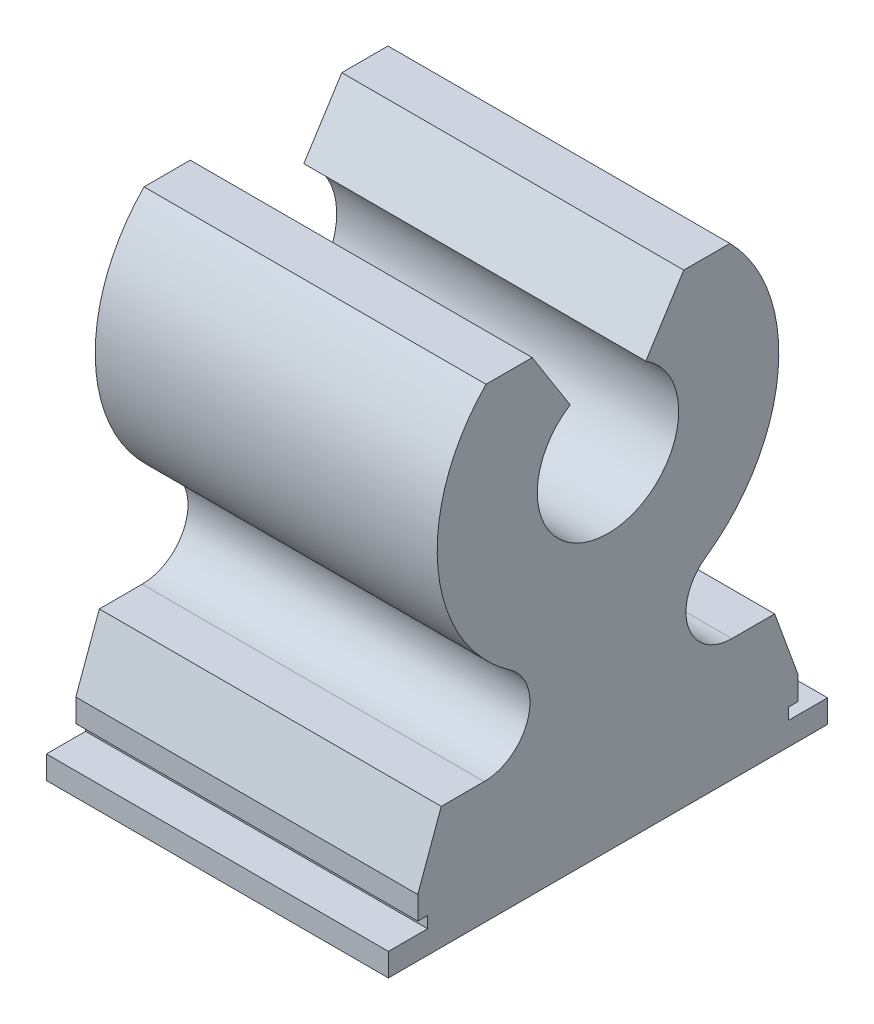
SolidWorks part; units mm, degrees
ref_plane "Plane1" through (0, 0, 0) normal (0, 0, 1) x (1, 0, 0)
ref_plane "Plane2" through (0, 0, 0) normal (0, 1, 0) x (1, 0, 0)
ref_plane "Plane3" through (0, 0, 0) normal (1, 0, 0) x (0, 0, -1)
sketch "BodySke" plane through (0, 0, 0) normal (1, 0, 0) x (0, 0, -1)
  line L0 (-5.715, -9) -> (5.715, -9)
  line L1 (5.715, -9) -> (5.715, -8.4)
  line L2 (5.715, -8.4) -> (4.695, -8.4)
  line L3 (-5.715, -9) -> (-5.715, -8.4)
  line L4 (-5.715, -8.4) -> (-4.695, -8.4)
  line L5 (4.695, -8.4) -> (4.695, -8.1)
  line L6 (-4.695, -8.4) -> (-4.695, -8.1)
  line L7 (4.695, -8.1) -> (4.95, -8.1)
  line L8 (-4.695, -8.1) -> (-4.95, -8.1)
  line L9 (-3.2237, -5.82) -> (-4.3385, -5.82)
  line L11 (4.3385, -5.82) -> (3.2237, -5.82)
  line L12 (0, 7.62) -> (0, -11.43) construction
  line L13 (7.62, 0) -> (-7.62, 0) construction
  line L14 (2.03, -2.8908) -> (2.03, -7.62) construction
  line L15 (-2.03, -2.8908) -> (-2.03, -7.62) construction
  line L16 (4.3385, -5.82) -> (4.95, -7.5)
  line L17 (4.95, -7.5) -> (4.95, -8.1)
  line L18 (-4.3385, -5.82) -> (-4.95, -7.5)
  line L19 (-4.95, -7.5) -> (-4.95, -8.1)
  line L20 (-0.985, 1.5541) -> (-2.3795, 3.7544)
  line L21 (0.985, 1.5541) -> (2.3795, 3.7544)
  arc A0 (-0.985, 1.5541) -> (0.985, 1.5541) centre (0, 0) ccw
  arc A1 (2.5412, -3.6469) -> (2.3795, 3.7544) centre (0, 0) ccw
  arc A2 (3.2237, -5.82) -> (2.5412, -3.6469) centre (3.2237, -4.6263) cw
  arc A3 (-2.5412, -3.6469) -> (-3.2237, -5.82) centre (-3.2237, -4.6263) cw
  arc A4 (-2.3795, 3.7544) -> (-2.5412, -3.6469) centre (0, 0) ccw
  dimension "Thread_min" = 3.68
  dimension "C_dia" = 8.89
  dimension "J_dim" = 4.06
  dimension "E_dim" = 11.43
  dimension "D_dim" = 3.18
  dimension "Clinch_ht" = 0.6
  dimension "Side_ht" = 0.6
  dimension "Groove_wid" = 0.3
  dimension "A_dim" = 9.9
  dimension "Groove_overall" = 9.39
  dimension "F_dim" = 9
  dimension "D12" = 20
  dimension "H_dim" = 1.97
extrude "Body" add sketch "BodySke" along normal blind 8.9
sketch "TopCutSke" plane through (0, 0, 0) normal (-1, 0, 0) x (0, 0, 1)
  line L0 (0, 0) -> (0, 6.35) construction
  line L1 (-4.445, 3.1115) -> (4.445, 3.1115)
  line L2 (-4.445, 3.1115) -> (-4.445, 12.0015)
  line L3 (-4.445, 12.0015) -> (4.445, 12.0015)
  line L4 (4.445, 3.1115) -> (4.445, 12.0015)
  dimension "Offset" = 3.1115
  dimension "Width" = 8.89
extrude "TopCut" cut sketch "TopCutSke" against normal blind 8.9
equation "' \"Length@Body\" = 8.9"
equation "' \"A_dim@BodySke\" = 9.9"
equation "' \"C_dia@BodySke\" = 8.89"
equation "' \"D_dim@BodySke\" = 3.18"
equation "' \"E_dim@BodySke\" = 11.43"
equation "' \"F_dim@BodySke\" = 9"
equation "' \"H_dim@BodySke\" = 1.97"
equation "' \"J_dim@BodySke\" =  4.06"
equation "' \"Thread_min@BodySke\" = 3.68"
equation "\"Width@TopCutSke\" = \"C_dia@BodySke\""
equation "\"Offset@TopCutSke\" = \"C_dia@BodySke\" * 0.35"
equation "\"Length@TopCut\" = \"Length@Body\""
equation "\"Clinch_ht@BodySke\" = 1 * 0.6"
equation "\"Groove_wid@BodySke\" = \"Clinch_ht@BodySke\" / 2"
equation "\"Groove_overall@BodySke\" = \"A_dim@BodySke\" - ( \"E_dim@BodySke\" - \"A_dim@BodySke\") / 3"
equation "\"Side_ht@BodySke\" = \"Clinch_ht@BodySke\""
